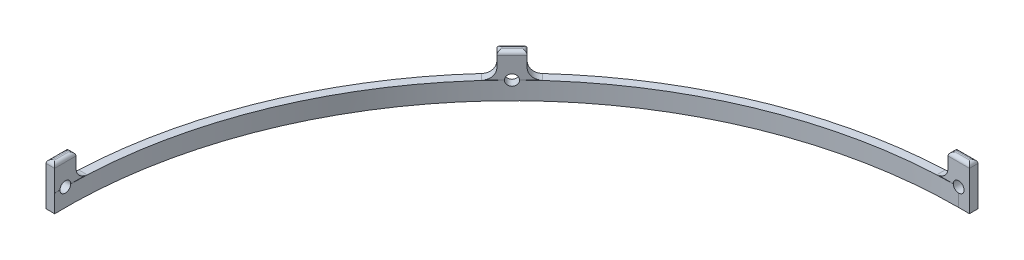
SolidWorks part; units mm, degrees
ref_plane "前视基准面" through (0, 0, 0) normal (0, 0, 1) x (1, 0, 0)
ref_plane "上视基准面" through (0, 0, 0) normal (0, 1, 0) x (1, 0, 0)
ref_plane "右视基准面" through (0, 0, 0) normal (1, 0, 0) x (0, 0, -1)
other "Configuration Table"
sketch "草图1" plane through (0, 0, 0) normal (0, 1, 0) x (1, 0, 0)
  line L0 (0, 125) -> (3, 125)
  line L1 (3, 125) -> (3, 127.4)
  line L2 (3, 127.4) -> (0, 127.4)
  line L3 (0, -127.4) -> (3, -127.4)
  line L4 (3, -127.4) -> (3, -125)
  line L5 (3, -125) -> (0, -125)
  arc A0 (0, 125) -> (0, -125) centre (0, 0) ccw
  arc A1 (0, 127.4) -> (0, -127.4) centre (0, 0) ccw
  dimension "D1" = 2.4
extrude "凸台-拉伸1" add sketch "草图1" along normal blind 5
sketch "草图2" plane through (0, 0, 0) normal (0, 1, 0) x (1, 0, 0)
  line L0 (0, 127.4) -> (0, -127.4) construction
  line L1 (0, 0) -> (-58.5384, 0) construction
  line L2 (0, 0) -> (-35.9373, 35.9373) construction
  line L3 (0, 0) -> (-33.1964, -33.1964) construction
  line L8 (-127.4, 0) -> (-125, 0) construction
  line L9 (-87.9641, 92.2067) -> (-92.2067, 87.9641)
  line L10 (-127.4, 3) -> (-125, 3)
  line L11 (-127.4, 3) -> (-127.4, -3)
  line L12 (-127.4, -3) -> (-125, -3)
  line L13 (-125, 3) -> (-125, -3)
  line L14 (-127.4, 3) -> (-125, -3) construction
  line L15 (-127.4, -3) -> (-125, 3) construction
  line L16 (-87.9641, 92.2067) -> (-86.267, 90.5097)
  line L17 (-86.267, 90.5097) -> (-90.5097, 86.267)
  line L18 (-92.2067, 87.9641) -> (-90.5097, 86.267)
  line L19 (3, 127.4) -> (-3, 127.4)
  line L20 (3, 127.4) -> (3, 125)
  line L21 (3, 125) -> (-3, 125)
  line L22 (-3, 127.4) -> (-3, 125)
  line L23 (-92.2067, -87.9641) -> (-87.9641, -92.2067)
  line L24 (-92.2067, -87.9641) -> (-90.5097, -86.267)
  line L25 (-90.5097, -86.267) -> (-86.267, -90.5097)
  line L26 (-87.9641, -92.2067) -> (-86.267, -90.5097)
  line L27 (-3, -127.4) -> (3, -127.4)
  line L28 (-3, -127.4) -> (-3, -125)
  line L29 (-3, -125) -> (3, -125)
  line L30 (3, -127.4) -> (3, -125)
  arc A0 (0, 127.4) -> (0, -127.4) centre (0, 0) ccw construction
  arc A1 (0, 125) -> (0, -125) centre (0, 0) ccw construction
  point P27 (-126.2, 0)
  point P39 (0, 0)
  point P48 (0, 0)
  dimension "D1" = 3
  dimension "D2" = 2.4
  dimension "D3" = 6
  dimension "D4" = 3
extrude "凸台-拉伸2" add sketch "草图2" along normal blind 12
fillet "圆角1" radius 3 1 edges at (-3, 5, 126.1823)
sketch "草图3" plane through (0, 0, 0) normal (0, 0, 1) x (1, 0, 0)
  line L0 (0, 0) -> (0, 32.4821) construction
fillet "圆角2" radius 3 1 edges at (-87.1031, 5, 91.3457)
fillet "圆角3" radius 3 1 edges at (-91.3457, 5, 87.1031)
fillet "圆角4" radius 3 1 edges at (-126.1823, 5, 3)
fillet "圆角5" radius 3 1 edges at (-126.1823, 5, -3)
fillet "圆角6" radius 3 1 edges at (-91.3457, 5, -87.1031)
fillet "圆角7" radius 3 1 edges at (-87.1031, 5, -91.3457)
fillet "圆角8" radius 3 1 edges at (-3, 5, -126.1823)
sketch "草图4" plane through (0, 0, 127.4) normal (0, 0, 1) x (1, 0, 0)
  line L0 (0, -200000) -> (0, 200032.4821) construction
  circle A0 centre (0, 5) radius 1.5
extrude "切除-拉伸1" cut sketch "草图4" against normal blind 3
pattern_circular "阵列(圆周)2" count 5 every 45 about axis through (0, 0, 0) along (0, 1, 0) of "切除-拉伸1"
fillet "圆角9" radius 1 20 edges at (0, 12, -127.4) (3, 12, -126.2) (0, 12, -125) (-3, 12, -126.2) (-90.0854, 12, -90.0854) (-87.1156, 12, -91.3582) (-88.3883, 12, -88.3883) (-91.3582, 12, -87.1156) (-126.2, 12, 3) (-127.4, 12, 0) (-126.2, 12, -3) (-125, 12, 0) (-90.0854, 12, 90.0854) (-91.3582, 12, 87.1156) (-88.3883, 12, 88.3883) (-87.1156, 12, 91.3582) (0, 12, 127.4) (-3, 12, 126.2) (0, 12, 125) (3, 12, 126.2)
sketch "草图5" plane through (0, 0, 0) normal (0, 1, 0) x (1, 0, 0)
  line L1 (-127.4, -3) -> (3, -3)
  line L2 (-127.4, -3) -> (-127.4, -127.4)
  line L3 (-127.4, -127.4) -> (3, -127.4)
  line L4 (3, -3) -> (3, -127.4)
extrude "切除-拉伸2" cut sketch "草图5" along normal through all
